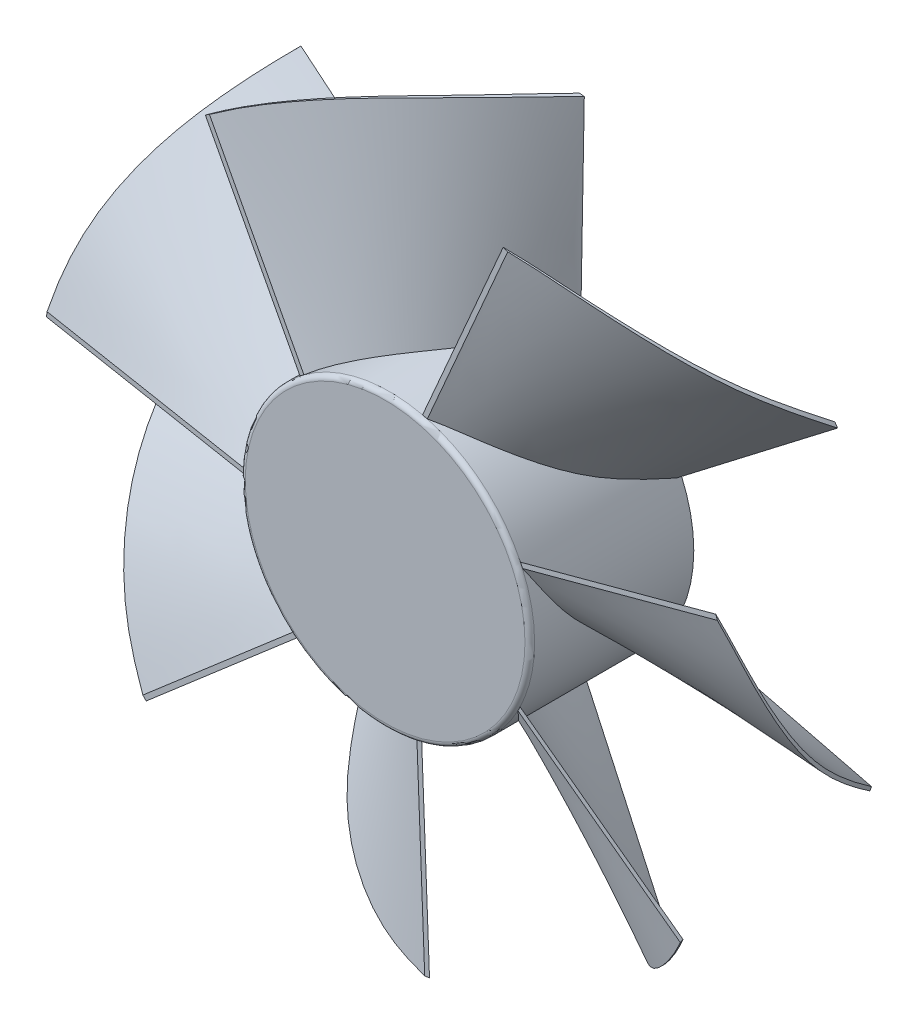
SolidWorks part; units mm, degrees
ref_plane "Front Plane" through (0, 0, 0) normal (0, 0, 1) x (1, 0, 0)
ref_plane "Top Plane" through (0, 0, 0) normal (0, 1, 0) x (1, 0, 0)
ref_plane "Right Plane" through (0, 0, 0) normal (1, 0, 0) x (0, 0, -1)
sketch "Sketch1" plane through (0, 0, 0) normal (0, 0, 1) x (1, 0, 0)
  circle A0 centre (0, 0) radius 15
  dimension "D1" = 30
extrude "Extrude1" add sketch "Sketch1" along normal mid plane 17
ref_plane "Plane1" through (0, 0, 8) normal (0, 0, 1) x (1, 0, 0)
ref_plane "Plane2" through (0, 0, -8) normal (0, 0, 1) x (1, 0, 0)
sketch "Sketch2" plane through (0, 0, -8) normal (0, 0, 1) x (1, 0, 0)
  line L0 (7.6781, -5.5138) -> (36, -12.5151)
  line L2 (36, -12) -> (7.6833, -5)
  line L3 (7.6833, -5) -> (7.6781, -5.5138)
  line L4 (0, 0) -> (30.2846, 0) construction
  line L5 (36, -12) -> (36, -12.5151)
  dimension "D1" = 0.5
  dimension "D2" = 36
  dimension "D3" = 5
  dimension "D4" = 12
sketch "Sketch3" plane through (0, 0, 8) normal (0, 0, 1) x (1, 0, 0)
  line L0 (10.0129, 5.5169) -> (36, 12.5178)
  line L1 (36, 12.5178) -> (36, 12)
  line L2 (36, 12) -> (10.0163, 5)
  line L3 (10.0163, 5) -> (10.0129, 5.5169)
  line L5 (0, 0) -> (30.2846, 0) construction
  dimension "D1" = 0.5
  dimension "D2" = 36
  dimension "D3" = 5
  dimension "D4" = 12
ref_plane "Plane3" through (36, 0, 0) normal (1, 0, 0) x (0, 0, -1)
sketch "Sketch4" plane through (36, 0, 0) normal (1, 0, 0) x (0, 0, -1)
  spline S0 degree 3 poles (-8, 12) (-7.419, 10.0548) (-5.4743, 3.5438) (-0.2729, -5.231) (5.656, -10.4512) (8, -12.5151) knots 0 0 0 0 0.204837 0.685626 1 1 1 1
loft "Loft4" add profiles "Sketch2", "Sketch3"
sketch "Sketch7" plane through (0, 0, 8.5) normal (0, 0, 1) x (1, 0, 0)
  line L0 (29.5378, 20.2537) -> (37.771, 20.2537)
  line L1 (37.771, 20.2537) -> (37.771, -21.0832)
  line L2 (37.771, -21.0832) -> (28.9515, -21.0832)
  arc A0 (28.9515, -21.0832) -> (29.5378, 20.2537) centre (0, 0) ccw
extrude "Cut-Extrude3" cut sketch "Sketch7" against normal through all
pattern_circular "CirPattern1" count 7 over 360 about axis through (0, 0, 8.5) along (0, 0, -1) of "Loft4", "Cut-Extrude3"
sketch "Sketch6" plane through (0, 0, -8.5) normal (0, 0, -1) x (-1, 0, 0)
  circle A0 centre (0, 0) radius 14.1724
extrude "Cut-Extrude2" cut sketch "Sketch6" against normal blind 16
fillet "Fillet1" radius 0.5 1 edges at (15, 0, 8.5)
